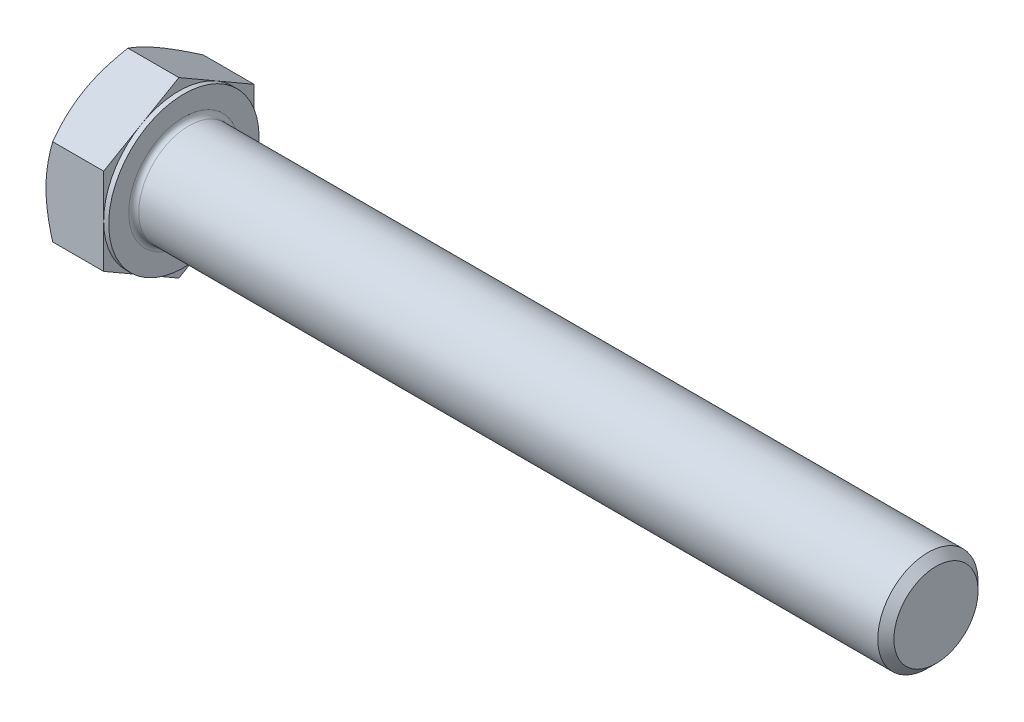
SolidWorks part; units mm, degrees
extrude "BaseHead" add sketch "Sketch1" along normal blind 7.5
sketch "Sketch1" plane through (0, 0, 0) normal (1, 0, 0) x (0, 0, -1)
  line L0 (9, 5.1962) -> (9, -5.1962)
  line L1 (-9, 5.1962) -> (-9, -5.1962)
  line L2 (9, -5.1962) -> (0, -10.3923)
  line L3 (0, -10.3923) -> (-9, -5.1962)
  line L4 (9, 5.1962) -> (0, 10.3923)
  line L5 (0, 10.3923) -> (-9, 5.1962)
revolve "HeadChamfer" cut sketch "Sketch3" angle 360 about L6
sketch "Sketch3" plane through (0, 0, 0) normal (0, 0, 1) x (1, 0, 0)
  line L0 (0, 9) -> (3.6906, 15.3923)
  line L1 (0, 10.3923) -> (0, 5.1962) construction
  line L2 (3.6906, 15.3923) -> (3.6906, 20.3923)
  line L3 (3.6906, 20.3923) -> (-10, 20.3923)
  line L4 (-10, 20.3923) -> (-10, 9)
  line L5 (-10, 9) -> (0, 9)
  line L6 (0, 0) -> (99.06, 0) construction
  line L7 (7.5, 10.3923) -> (0, 10.3923) construction
ref_plane "Plane1" through (0, 0, 0) normal (0, 0, 1) x (1, 0, 0)
ref_plane "Plane2" through (0, 0, 0) normal (0, 1, 0) x (1, 0, 0)
ref_plane "Plane3" through (0, 0, 0) normal (1, 0, 0) x (0, 0, -1)
sketch "BodySke" plane through (0, 0, 0) normal (0, 0, 1) x (1, 0, 0)
  line L0 (0, 5.1962) -> (0, -5.1962) construction
  line L1 (0, 0) -> (97.5, 0)
  line L2 (0, 0) -> (0, 6)
  line L3 (0, 6) -> (96.536, 6)
  line L4 (97.5, 0) -> (97.5, 5.036)
  line L5 (7.5, 10.3923) -> (7.5, 5.1962) construction
  line L6 (97.5, 5.036) -> (96.536, 6)
  line L7 (0, 0) -> (96.52, 0) construction
  line L8 (97.5, -5.036) -> (96.536, -6) construction
  line L9 (0, -6) -> (96.536, -6) construction
  line L10 (9.25, 15.24) -> (9.25, -1.27) construction
  line L11 (67.5, 15.24) -> (67.5, -1.27) construction
  line L12 (7.5, 5.1962) -> (7.5, -5.1962) construction
revolve "BaseBody" add sketch "BodySke"
fillet "HeadFillet" radius 0.6 1 edges at (7.5, 0, -6)
sketch "Sketch4" plane through (0, 0, 0) normal (0, 0, 1) x (1, 0, 0)
  line L1 (7.5, 10.3923) -> (7.5, 5.1962) construction
  line L2 (7.5, 9) -> (6.9, 9)
  line L3 (7.5, 9) -> (7.5, 20.3923)
  line L4 (7.5, 20.3923) -> (6.9, 20.3923)
  line L5 (0, 0) -> (95.25, 0) construction
  line L6 (0, 0) -> (96.52, 0) construction
  line L7 (6.9, 9) -> (6.9, 20.3923)
  line L8 (7.5, 10.3923) -> (0.8038, 10.3923) construction
revolve "BearingFace" cut sketch "Sketch4" angle 360 about L5
sketch "ThdSchSke" plane through (0, 0, 0) normal (0, 0, 1) x (1, 0, 0)
  line L0 (67.5, -5.036) -> (66.825, -6)
  line L1 (67.5, -5.036) -> (68.175, -6)
  line L2 (68.175, -6) -> (68.175, -7.5)
  line L3 (-3.175, 0) -> (5.1513, 0) construction
  line L5 (68.175, -7.5) -> (66.825, -7.5)
  line L6 (66.825, -7.5) -> (66.825, -6)
revolve "ThreadSchematic" [suppressed] cut sketch "ThdSchSke" angle 360 about L3
pattern_linear "ThdSchPat" [suppressed]
equation "\"D3@Sketch1\" = \"Width_flats@Sketch1\" / 2"
equation "\"D4@Sketch1\" = \"D3@Sketch1\""
equation "\"D5@Sketch1\" = \"D4@Sketch1\""
equation "\"Thread_minor@ThreadCosmetic\" = \"Minor_dia@BodySke\""
equation "\"D1@Sketch3\" = \"Width_flats@Sketch1\" / 2"
equation "\"D1@Sketch4\" = \"Width_flats@Sketch1\""
equation "\"Thread_length@ThreadCosmetic\" = ((sgn( (\"Length@BodySke\" - \"Advance@BodySke\" ) - \"Thread_nom@BodySke\" )-1)*( (\"Length@BodySke\" - \"Advance@BodySke\" ) - \"Thread_nom@BodySke\" ))/-2+ \"Thread_nom@BodySke\""
equation "\"Thread_minor@ThdSchSke\" = \"Minor_dia@BodySke\""
equation "\"Diameter@ThdSchSke\" = \"Diameter@BodySke\""
equation "\"Overcut@ThdSchSke\" = \"Diameter@BodySke\" * 1.25"
equation "\"Start@ThdSchSke\" = \"Head_ht@BaseHead\" + \"Length@BodySke\" - \"Thread_length@ThreadCosmetic\"  '---Non-countersunk---"
equation "\"Num_threads@ThdSchPat\" = int( \"Thread_length@ThreadCosmetic\" / \"Advance@BodySke\" + 0.999 )  + 1"
equation "\"Advance@ThdSchPat\" = \"Thread_length@ThreadCosmetic\" /  (\"Num_threads@ThdSchPat\" - 1) 'relax it"
equation "\"Num_threads@ThdSchPat\" = \"Num_threads@ThdSchPat\" - sgn( \"Num_threads@ThdSchPat\" - 1) '---chamfered tips only---"
